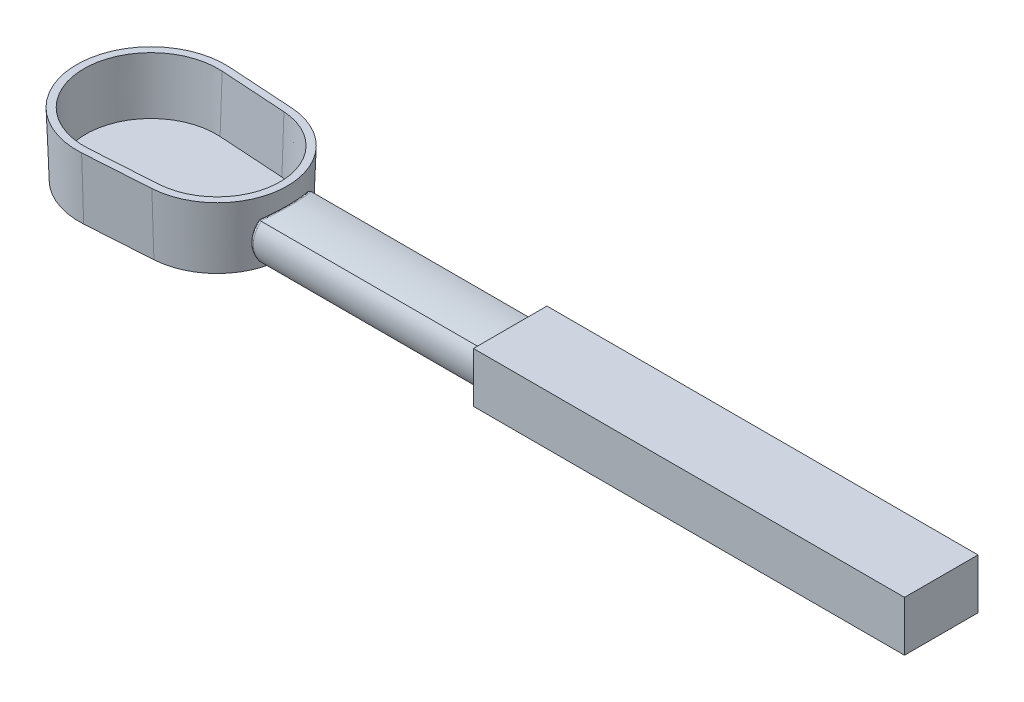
SolidWorks part; units mm, degrees
ref_plane "Front Plane" through (0, 0, 0) normal (0, 0, 1) x (1, 0, 0)
ref_plane "Top Plane" through (0, 0, 0) normal (0, 1, 0) x (1, 0, 0)
ref_plane "Right Plane" through (0, 0, 0) normal (1, 0, 0) x (0, 0, -1)
sketch "Sketch1" plane through (0, 0, 0) normal (0, 1, 0) x (1, 0, 0)
  line L0 (3.2486, 50.834) -> (49.923, 47.8512)
  line L1 (0, 0) -> (46.865, 0) construction
  line L2 (3.2486, -50.834) -> (49.923, -47.8512)
  arc A0 (3.2486, 50.834) -> (3.2486, -50.834) centre (0, 0) ccw
  arc A1 (49.923, -47.8512) -> (49.923, 47.8512) centre (46.865, 0) ccw
extrude "Extrude1" add sketch "Sketch1" along normal blind 44.45 draft 2
sketch "Sketch2" plane through (0, 0, 0) normal (1, 0, 0) x (0, 0, -1)
  line L0 (0, 19.05) -> (41.5371, 19.05) construction
  line L1 (0, 19.05) -> (0, 45.4101) construction
  arc A0 (-17.9305, 31.5804) -> (-17.9305, 6.5196) centre (0, 19.05) ccw
  arc A1 (-17.9305, 31.5804) -> (17.9305, 31.5804) centre (0, -55.5675) cw
  arc A2 (-17.9305, 6.5196) -> (17.9305, 6.5196) centre (0, 93.6675) ccw
  arc A3 (17.9305, 6.5196) -> (17.9305, 31.5804) centre (0, 19.05) ccw
extrude "Extrude2" add sketch "Sketch2" along normal blind 254
sketch "Sketch3" plane through (254, 0, 0) normal (1, 0, 0) x (0, 0, -1)
  line L0 (17.9305, 31.5804) -> (-17.9305, 6.5196) construction
  line L1 (-25.9873, 36.7831) -> (25.9873, 36.7831)
  line L2 (-25.9873, 36.7831) -> (-25.9873, 1.3169)
  line L3 (-25.9873, 1.3169) -> (25.9873, 1.3169)
  line L4 (25.9873, 36.7831) -> (25.9873, 1.3169)
  line L5 (0, 19.05) -> (0, 36.7831) construction
  line L6 (0, 19.05) -> (25.9873, 19.05) construction
extrude "Extrude3" add sketch "Sketch3" along normal blind 304.8
split "Split1" bodies to split 103 resulting bodies 104 105
shell "Shell2" thickness 5.08
fillet "Fillet1" radius 2.54 4 edges at (90.3093, 19.6916, -21.8655) (94.8421, 4.7689, 3.645) (90.2519, 18.0507, 21.8521) (95.8269, 33.3228, -3.8427)
